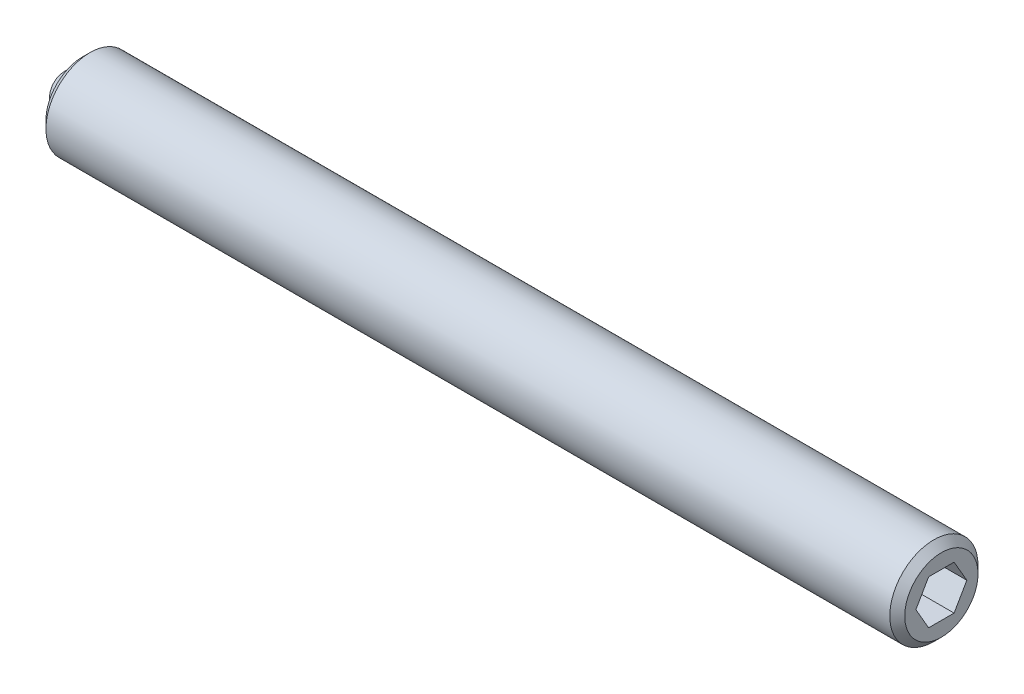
SolidWorks part; units mm, degrees
ref_plane "Front Plane" through (0, 0, 0) normal (0, 0, 1) x (1, 0, 0)
ref_plane "Top Plane" through (0, 0, 0) normal (0, 1, 0) x (1, 0, 0)
ref_plane "Right Plane" through (0, 0, 0) normal (1, 0, 0) x (0, 0, -1)
sketch "Sketch2" plane through (0, 0, 0) normal (1, 0, 0) x (0, 0, -1)
  circle A0 centre (0, 0) radius 1.5
  dimension "D1" = 3
extrude "Boss-Extrude1" add sketch "Sketch2" along normal blind 29.2
sketch "Sketch3" plane through (0, 0, 0) normal (-1, 0, 0) x (0, 0, 1)
  circle A0 centre (0, 0) radius 0.8
  dimension "D1" = 1.6
chamfer "Chamfer1" distance 0.254 angle 45 1 edges at (0, 0, -1.5)
chamfer "Chamfer2" distance 0.254 angle 45 1 edges at (29.2, 0, -1.5)
sketch "Sketch4" plane through (29.2, 0, 0) normal (1, 0, 0) x (0, 0, -1)
  line L1 (0.866, 0) -> (0.433, 0.75)
  line L2 (0.433, 0.75) -> (-0.433, 0.75)
  line L3 (-0.433, 0.75) -> (-0.866, 0)
  line L4 (-0.866, 0) -> (-0.433, -0.75)
  line L5 (-0.433, -0.75) -> (0.433, -0.75)
  line L6 (0.433, -0.75) -> (0.866, 0)
  circle A0 centre (0, 0) radius 0.75 construction
  dimension "D1" = 1.5
extrude "Cut-Extrude2" cut sketch "Sketch4" against normal blind 2
extrude "Cut-Extrude3" cut sketch "Sketch3" against normal blind 0.8
sketch "Sketch5" plane through (0, 0, 0) normal (-1, 0, 0) x (0, 0, 1)
  line L0 (0, 0) -> (0, -0.8)
  line L1 (0, 0) -> (0, 0.8)
  arc A0 (0, 0.8) -> (0, -0.8) centre (0, 0) ccw
  dimension "D1" = 0.8
revolve "Revolve1" add sketch "Sketch5" angle 360 about L1
